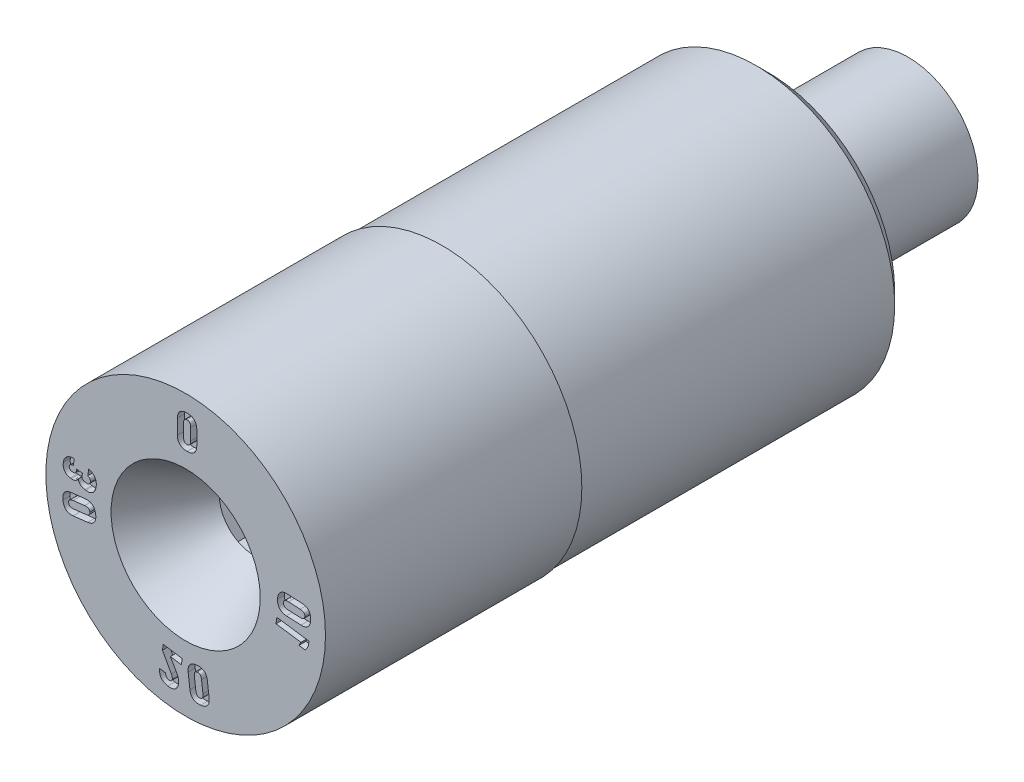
SolidWorks part; units mm, degrees
other "<M6L12-SetScrew>-<Chamfer1>"
ref_plane "Front Plane" through (0, 0, 0) normal (0, 0, 1) x (1, 0, 0)
ref_plane "Top Plane" through (0, 0, 0) normal (0, 1, 0) x (1, 0, 0)
ref_plane "Right Plane" through (0, 0, 0) normal (1, 0, 0) x (0, 0, -1)
sketch "Sketch1" plane through (0, 0, 0) normal (1, 0, 0) x (0, 0, -1)
  line L0 (0, 3.2) -> (2.9445, 1.5)
  line L2 (0, 6) -> (0, 3.2)
  line L3 (24.425, 6) -> (0, 6)
  line L4 (-3.7979, 0) -> (49996.2021, 0) construction
  line L8 (19, 1.5) -> (2.9445, 1.5)
  line L12 (25, 3) -> (25, 5.425)
  line L16 (25, 5.425) -> (24.425, 6)
  line L17 (25, 3) -> (19, 3)
  line L18 (19, 1.5) -> (19, 3)
  dimension "D1" = 25
  dimension "D2" = 45
  dimension "D3" = 0.575
  dimension "D4" = 12
  dimension "D5" = 30
  dimension "D6" = 3.2
  dimension "D7" = 3
  dimension "D8" = 6
  dimension "D9" = 6
revolve "Revolve1" add sketch "Sketch1" angle 360 about L4
sketch "Sketch5" plane through (0, 0, 0) normal (1, 0, 0) x (0, 0, -1)
  line L0 (0, 0) -> (50000, 0) construction
  line L1 (0, 6) -> (0, -6) construction
  line L2 (11, 5.935) -> (25, 5.935)
  line L3 (11, 5.935) -> (11, 6.935)
  line L4 (11, 6.935) -> (25, 6.935)
  line L5 (25, 5.935) -> (25, 6.935)
  line L6 (25, -5.425) -> (25, 5.425) construction
  line L7 (24.425, 6) -> (0, 6) construction
  dimension "D1" = 11
  dimension "D2" = 0.065
  dimension "D3" = 1
revolve "Cut-Revolve1" cut sketch "Sketch5" angle 360 about L0
sketch "Sketch2" plane through (0, 0, 0) normal (0, 0, 1) x (1, 0, 0)
  line L0 (0, 0) -> (0, 6) construction
  line L1 (0, 0) -> (6, 0) construction
  line L2 (0, 0) -> (0, -6) construction
  line L3 (0, 0) -> (-6, 0) construction
  circle A0 centre (0, 0) radius 3.9375 construction
  circle A1 centre (0, 0) radius 6 construction
  text T0 "                 0              30             " font "Bahnschrift" height 1.39
  text T1 "                                                     20             10" font "Bahnschrift" height 1.39
  point P19 (0, 0)
  dimension "D1" = 7.875
  dimension "D2" = 4
extrude "Cut-Extrude1" cut sketch "Sketch2" against normal blind 0.3
ref_plane "Plane1" through (0, 0, -2.9445) normal (0, 0, 1) x (1, 0, 0)
sketch "Sketch6" plane through (0, 0, -2.9445) normal (0, 0, 1) x (1, 0, 0)
  line L1 (1.7321, 0) -> (0.866, 1.5)
  line L2 (0.866, 1.5) -> (-0.866, 1.5)
  line L3 (-0.866, 1.5) -> (-1.7321, 0)
  line L4 (-1.7321, 0) -> (-0.866, -1.5)
  line L5 (-0.866, -1.5) -> (0.866, -1.5)
  line L6 (0.866, -1.5) -> (1.7321, 0)
  circle A0 centre (0, 0) radius 1.5 construction
  circle A1 centre (0, 0) radius 1.5 construction
  point P1 (0, 1.5)
extrude "Cut-Extrude2" cut sketch "Sketch6" against normal blind 3
inserted part "M6L12-SetScrew"
move or copy body "Body-Move/Copy2" placed by mates yes
other "Distance1" parameters "D1"=6
